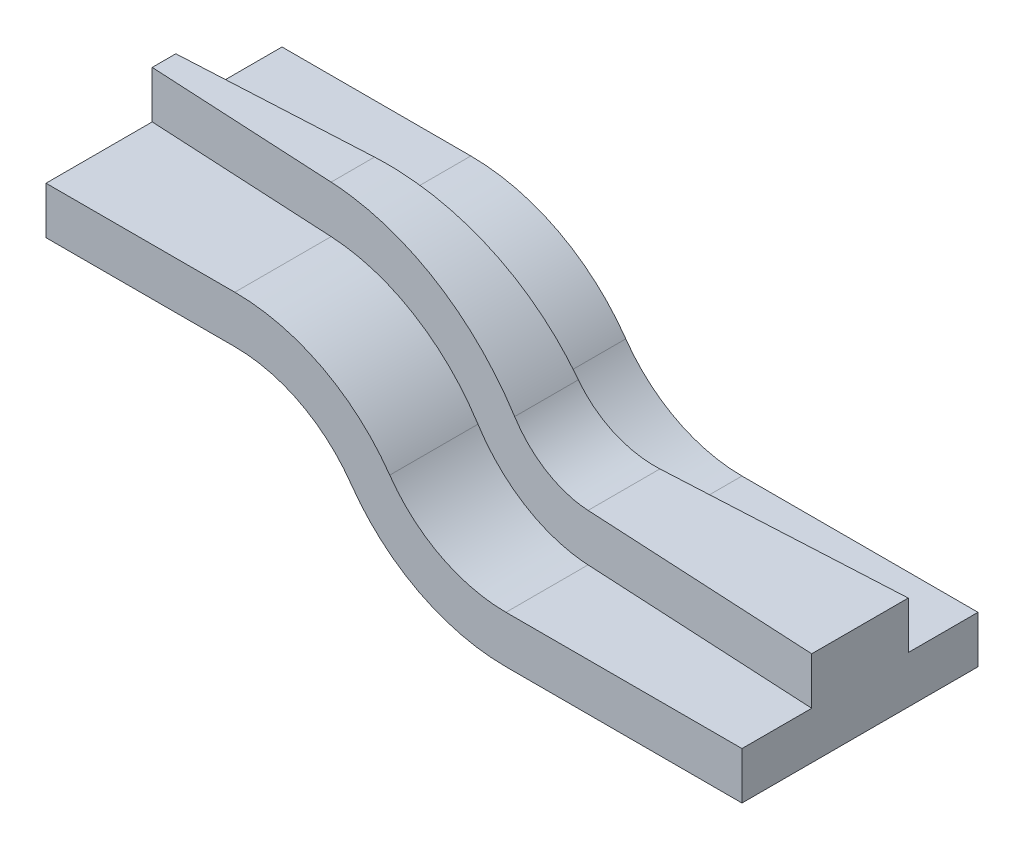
SolidWorks part; units mm, degrees
ref_plane "Front Plane" through (0, 0, 0) normal (0, 0, 1) x (1, 0, 0)
ref_plane "Top Plane" through (0, 0, 0) normal (0, 1, 0) x (1, 0, 0)
ref_plane "Right Plane" through (0, 0, 0) normal (1, 0, 0) x (0, 0, -1)
sketch "Sketch1" plane through (0, 0, 0) normal (0, 0, 1) x (1, 0, 0)
  line L0 (0, 0) -> (40, 0)
  line L1 (97.4456, -30) -> (147.4456, -30)
  arc A0 (40, 0) -> (72.8261, -17.1429) centre (40, -40) cw
  arc A1 (72.8261, -17.1429) -> (97.4456, -30) centre (97.4456, 0) ccw
  dimension "D2" = 40
  dimension "D3" = 30
  dimension "D1" = 40
  dimension "D4" = 50
  dimension "D5" = 30
extrude "Extrude-Thin1" add sketch "Sketch1" along normal mid plane 50 thin
sketch "Sketch2" plane through (0, 0, 0) normal (0, 0, 1) x (1, 0, 0)
  line L2 (147.4456, -20) -> (147.4456, -30)
  line L3 (0, 10) -> (0, 0)
  line L4 (97.4456, -20) -> (147.4456, -20)
  line L5 (0, 10) -> (40, 10)
  line L6 (97.4456, -20) -> (147.4456, -20)
  line L7 (0, 10) -> (40, 10)
  arc A4 (81.0326, -11.4286) -> (97.4456, -20) centre (97.4456, 0) ccw
  arc A5 (81.0326, -11.4286) -> (40, 10) centre (40, -40) ccw
  arc A6 (81.0326, -11.4286) -> (97.4456, -20) centre (97.4456, 0) ccw
  arc A7 (81.0326, -11.4286) -> (40, 10) centre (40, -40) ccw
  dimension "D1" = 10
rib "Rib1" sketch "Sketch2" sketch "Sketch2" thickness 5 extrusion direction parallel to sketch draft on yes draft angle 3 parameters "D1"=5, "D3"=3
